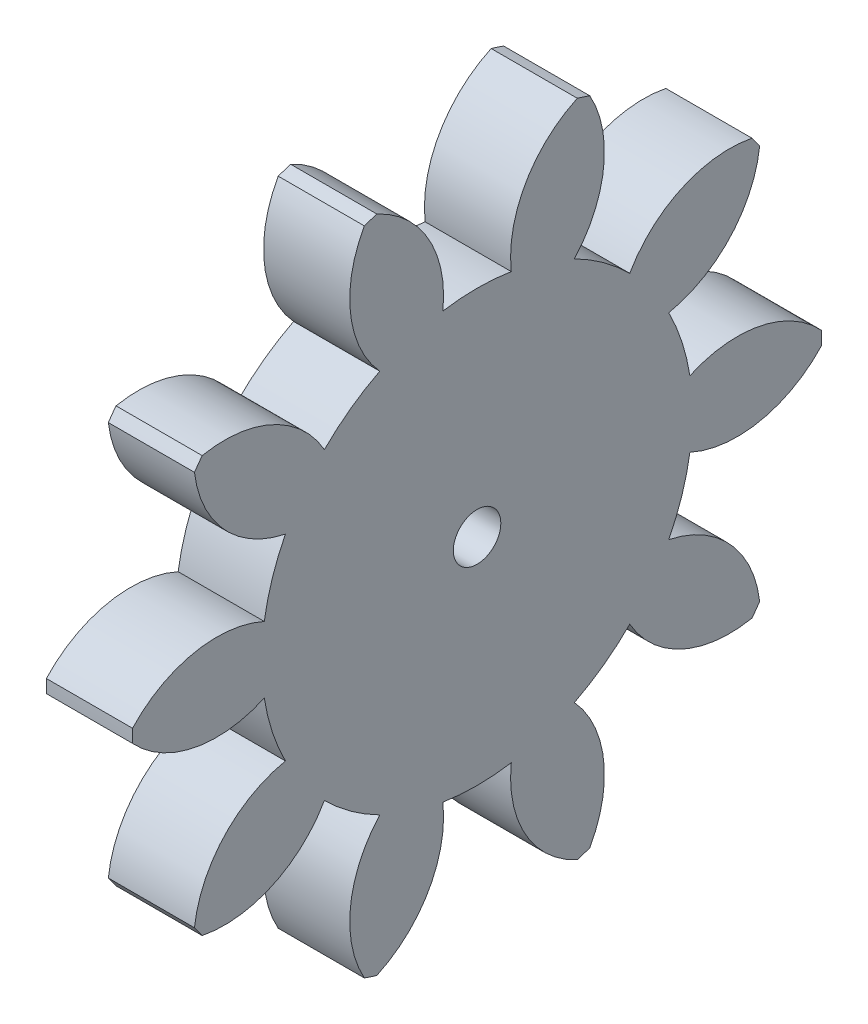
SolidWorks part; units mm, degrees
ref_plane "Plane1" through (0, 0, 0) normal (0, 0, 1) x (1, 0, 0)
ref_plane "Plane2" through (0, 0, 0) normal (0, 1, 0) x (1, 0, 0)
ref_plane "Plane3" through (0, 0, 0) normal (1, 0, 0) x (0, 0, -1)
sketch "HoldingSke" plane through (0, 0, 0) normal (0, 1, 0) x (1, 0, 0)
  line L0 (0, 0) -> (150.0847, -26.464)
  line L1 (-15, 0) -> (100, 0) construction
  line L2 (0, 0) -> (-2.1039, 2.3779)
  line L3 (0, 0) -> (-11.863, 4.5341)
  line L4 (0, 0) -> (8.5048, 1.4996)
  line L5 (0, 0) -> (-47.5972, -17.7524)
  line L6 (0, 0) -> (-5.2639, -3.5516)
  line L7 (-2.1039, 2.3779) -> (8.8308, 51.9871)
  line L8 (-76.2, 54.61) -> (-69.596, 54.61)
  line L9 (-71.009, 38.7566) -> (-53.1078, 45.2721)
  line L10 (-76.2, 71.12) -> (104.1128, 71.12)
  line L11 (0, 0) -> (-6.35, 0)
  line L12 (-76.2, 101.6) -> (-76.0298, 101.6)
  line L13 (24.9733, 27.94) -> (52.9518, 28.4284)
  line L14 (24.9733, 27.94) -> (24.9746, 27.94)
  line L15 (24.9733, 27.94) -> (100.4006, 29.5858)
  circle A0 centre (0, 0) radius 3.175
  circle A1 centre (0, 0) radius 15.8737
  circle A2 centre (0, 0) radius 38.1
  circle A3 centre (0, 0) radius 3.175
  dimension "MHD" = 31.7475
  dimension "Hub_dia" = 76.2
  dimension "Bore" = 6.35
  dimension "MBD" = 6.35
  dimension "Num_teeth" = 10
  dimension "Pitch_radius" = 180.3128
  dimension "Pitch" = 152.4
  dimension "Width" = 6.35
  dimension "Overall_len" = 50.8
  dimension "Show_teeth" = 10
  dimension "Thickness" = 6.35
  dimension "OAL" = 50.8001
  dimension "T_dim" = 6.604
  dimension "Ap" = 20
  dimension "H" = 19.05
  dimension "Backlash" = 0.1702
  dimension "Addendum_fac" = 1
  dimension "Dedendum_fac" = 1.25
  dimension "Clearance_fac" = 0.25
  dimension "Dedendum_add" = 0.0013
sketch "BasProSke" plane through (0, 0, 0) normal (0, 1, 0) x (1, 0, 0)
  line L0 (-10, 0) -> (60, 0) construction
  line L1 (0, 0) -> (0, 25.4)
  line L2 (0, 0) -> (6.35, 0)
  line L3 (6.35, 0) -> (6.35, 25.4)
  line L4 (6.35, 25.4) -> (0, 25.4)
  dimension "Diameter" = 50.8
  dimension "Thickness" = 6.35
revolve "Base-Revolve" add sketch "BasProSke" angle 360 about L0
sketch "TooCutSke" plane through (0, 0, 0) normal (1, 0, 0) x (0, 0, -1)
  line L1 (0, 0) -> (0, 107) construction
  line L2 (0, 0) -> (-3.6083, 20.8568) construction
  line L3 (0, 0) -> (-12.9485, 39.8513) construction
  line L4 (-3.6083, 20.8568) -> (-6.4742, 19.9257) construction
  arc A0 (2.5213, 15.6722) -> (-2.5213, 15.6722) centre (0, 0) ccw
  arc A1 (7.4225, 24.3178) -> (-7.4225, 24.3178) centre (0, 0) ccw
  circle A2 centre (0, 0) radius 21.1667 construction
  circle A3 centre (0, 0) radius 19.8902 construction
  arc A4 (-2.5213, 15.6722) -> (-7.4225, 24.3178) centre (-10.9354, 16.6143) ccw
  arc A5 (7.4225, 24.3178) -> (2.5213, 15.6722) centre (10.9354, 16.6143) ccw
  dimension "Root_dia" = 31.7475
  dimension "Overcut_dia" = 50.8508
  dimension "Pitch_dia" = 42.3333
  dimension "Base_dia" = 39.7803
  dimension "Flank_rad" = 8.4667
  dimension "Half_ang" = 18
  dimension "Half_CT" = 3.0134
extrude "ToothCut" cut sketch "TooCutSke" along normal through all
fillet "Breaks" [suppressed] radius 0.0847
fillet "RootFillets" [suppressed] radius 1.0596
pattern_circular "TeethCuts" count 10 every 36 about axis through (-10, 0, 0) along (1, 0, 0) of "ToothCut", "RootFillets", "Breaks"
sketch "HubNeaOneSke" plane through (0, 0, 0) normal (-1, 0, 0) x (0, 0, 1)
  circle A0 centre (0, 0) radius 15.8737
  dimension "Diameter" = 31.7475
extrude "HubNearOne" [suppressed] add sketch "HubNeaOneSke" along normal blind 44.4501
sketch "HubNeaBotSke" plane through (0, 0, 0) normal (-1, 0, 0) x (0, 0, 1)
  circle A0 centre (0, 0) radius 15.8737
  dimension "Diameter" = 31.7475
extrude "HubNearBoth" [suppressed] add sketch "HubNeaBotSke" along normal blind 22.225
ref_plane "FarPln" through (6.35, 0, 0) normal (1, 0, 0) x (0, 0, -1)
sketch "HubFarSke" plane through (6.35, 0, 0) normal (1, 0, 0) x (0, 0, -1)
  circle A0 centre (0, 0) radius 15.8737
  dimension "Diameter" = 31.7475
extrude "HubFar" [suppressed] add sketch "HubFarSke" along normal blind 22.225
sketch "BorSke" plane through (0, 0, 0) normal (1, 0, 0) x (0, 0, -1)
  circle A0 centre (0, 0) radius 3.175
  dimension "Diameter" = 6.35
extrude "Bore" cut sketch "BorSke" along normal mid plane 101.6001
sketch "KeySke" plane through (0, 0, 0) normal (1, 0, 0) x (0, 0, -1)
  line L0 (-0.127, 0) -> (-0.127, 3.429)
  line L1 (-0.127, 3.429) -> (0.127, 3.429)
  line L2 (0.127, 3.429) -> (0.127, 0)
  line L3 (0, 0) -> (0, 34) construction
  line L4 (-0.127, 0) -> (0.127, 0)
  dimension "Offset" = 3.429
  dimension "Width" = 0.254
extrude "Keyway" [suppressed] cut sketch "KeySke" along normal mid plane 101.6001
pattern_circular "Keyway2" [suppressed] count 2 every 90 about axis through (-10, 0, 0) along (1, 0, 0)
sketch "Sketch1" plane through (6.35, 0, 0) normal (1, 0, 0) x (0, 0, -1)
  circle A0 centre (0, 0) radius 3.175
  circle A1 centre (0, 0) radius 3.175 construction
  circle A2 centre (0, 0) radius 1.75
  dimension "D1" = 3.5
extrude "Boss-Extrude1" add sketch "Sketch1" against normal up to surface (6.35 mm away)
equation "' \"Pitch@HoldingSke\" = 4"
equation "' \"Num_teeth@HoldingSke\" = 12"
equation "' \"Ap@HoldingSke\" =  20"
equation "' \"Width@HoldingSke\" = 0.5"
equation "' \"Hub_dia@HoldingSke\"= 1"
equation "' \"Overall_len@HoldingSke\" = 1.0"
equation "' \"Bore@HoldingSke\" = 0.75"
equation "' \"T_dim@HoldingSke\" = 0.85"
equation "' \"Width@KeySke\" = 0.25"
equation "' \"Show_teeth@HoldingSke\" = 13"
equation "' \"Backlash@HoldingSke\" = 0.009"
equation "' \"Addendum_fac@HoldingSke\" = 1.0"
equation "' \"Dedendum_fac@HoldingSke\" = 1.25"
equation "' \"Dedendum_add@HoldingSke\" = 0.00005"
equation "' \"Clearance_fac@HoldingSke\" = 0.25"
equation "' \"Pitch@HoldingSke\" = 0.5"
equation "' \"Num_teeth@HoldingSke\" = 23"
equation "' \"Show_teeth@HoldingSke\" = 23"
equation "' \"Backlash@HoldingSke\" = 0.0375"
equation "\"Overcut_dia@TooCutSke\" = (\"Num_teeth@HoldingSke\" + 2 * \"Addendum_fac@HoldingSke\") / \"Pitch@HoldingSke\" + 0.002"
equation "\"Pitch_dia@TooCutSke\" = \"Num_teeth@HoldingSke\" / \"Pitch@HoldingSke\""
equation "\"Base_dia@TooCutSke\" = \"Num_teeth@HoldingSke\" / \"Pitch@HoldingSke\" * cos((\"Ap@HoldingSke\"  * 3.14159265 / 180))"
equation "\"Root_dia@TooCutSke\" = (\"Num_teeth@HoldingSke\" + 2) / \"Pitch@HoldingSke\" - 2 * (\"Addendum_fac@HoldingSke\" + \"Dedendum_fac@HoldingSke\") / \"Pitch@HoldingSke\" - \"Dedendum_add@HoldingSke\" * 2"
equation "\"Half_ang@TooCutSke\" = 180 / \"Num_teeth@HoldingSke\""
equation "\"Half_CT@TooCutSke\" = \"Num_teeth@HoldingSke\" / \"Pitch@HoldingSke\" * sin((3.14159265 / 2 / \"Num_teeth@HoldingSke\")) / 2 - 7 * \"Backlash@HoldingSke\" / 4"
equation "\"Flank_rad@TooCutSke\" = \"Num_teeth@HoldingSke\" / \"Pitch@HoldingSke\" / 5"
equation "\"Radius@RootFillets\" = \"Clearance_fac@HoldingSke\" / \"Pitch@HoldingSke\" + \"Dedendum_add@HoldingSke\""
equation "\"Break_rad@Breaks\" = 0.02 / \"Pitch@HoldingSke\""
equation "\"Thickness@HoldingSke\" = \"Width@HoldingSke\""
equation "\"OAL@HoldingSke\" = \"Thickness@HoldingSke\""
equation "\"MHD@HoldingSke\" = (\"Num_teeth@HoldingSke\" + 2) / \"Pitch@HoldingSke\" - 2 * (\"Addendum_fac@HoldingSke\" + \"Dedendum_fac@HoldingSke\")  / \"Pitch@HoldingSke\" - \"Dedendum_add@HoldingSke\" * 2"
equation "\"MBD@HoldingSke\" = (\"Num_teeth@HoldingSke\" + 2) / \"Pitch@HoldingSke\" - 2 * (\"Addendum_fac@HoldingSke\" + \"Dedendum_fac@HoldingSke\")  / \"Pitch@HoldingSke\" - \"Dedendum_add@HoldingSke\" * 2 - 0.002"
equation "\"MHD@HoldingSke\" = ((sgn( \"MHD@HoldingSke\" - \"Hub_dia@HoldingSke\" )-1)*( \"MHD@HoldingSke\" - \"Hub_dia@HoldingSke\" ))/-2+ \"Hub_dia@HoldingSke\""
equation "\"MBD@HoldingSke\" = ((sgn( \"MBD@HoldingSke\" - \"Bore@HoldingSke\" )-1)*( \"MBD@HoldingSke\" - \"Bore@HoldingSke\" ))/-2+ \"Bore@HoldingSke\""
equation "\"OAL@HoldingSke\" = ((sgn( \"OAL@HoldingSke\" - \"Overall_len@HoldingSke\" )+1)*( \"OAL@HoldingSke\" - \"Overall_len@HoldingSke\" ))/2 + \"Overall_len@HoldingSke\" + 0.000002"
equation "\"Num_teeth@TeethCuts\" = int( \"Show_teeth@HoldingSke\" ) + 1"
equation "\"Num_teeth@TeethCuts\" = ((sgn( \"Num_teeth@TeethCuts\" - \"Num_teeth@HoldingSke\" )-1)*( \"Num_teeth@TeethCuts\" - \"Num_teeth@HoldingSke\" ))/-2+ \"Num_teeth@HoldingSke\""
equation "\"Num_teeth@TeethCuts\" = ((sgn( \"Num_teeth@TeethCuts\" - 2.0)+1)*( \"Num_teeth@TeethCuts\" - 2.0))/2 +2.0"
equation "\"Angle@TeethCuts\" = 360.0 / \"Num_teeth@HoldingSke\""
equation "\"Diameter@BasProSke\" = (\"Num_teeth@HoldingSke\" + 2 * \"Addendum_fac@HoldingSke\") / \"Pitch@HoldingSke\""
equation "\"Thickness@BasProSke\"  = \"Thickness@HoldingSke\""
equation "' \"Fillet_rad@BasProSke\" =  \"Thickness@HoldingSke\" * 0.05"
equation "\"MHD@HoldingSke\" = ((sgn( \"MHD@HoldingSke\" - \"Root_dia@TooCutSke\" )-1)*( \"MHD@HoldingSke\" - \"Root_dia@TooCutSke\" ))/-2+ \"Root_dia@TooCutSke\""
equation "\"Diameter@HubNeaOneSke\" = \"MHD@HoldingSke\""
equation "\"Length@HubNearOne\" = \"OAL@HoldingSke\" - \"Thickness@BasProSke\""
equation "\"Diameter@HubNeaBotSke\" = \"MHD@HoldingSke\""
equation "\"Length@HubNearBoth\" = ( \"OAL@HoldingSke\" - \"Thickness@BasProSke\" ) / 2.0"
equation "\"Thickness@FarPln\" = \"Thickness@BasProSke\""
equation "\"Diameter@HubFarSke\" = \"MHD@HoldingSke\""
equation "\"Length@HubFar\" = ( \"OAL@HoldingSke\" - \"Thickness@BasProSke\" ) / 2.0"
equation "\"Diameter@BorSke\" = \"MBD@HoldingSke\""
equation "\"D1@Bore\" = \"OAL@HoldingSke\" * 2.0"
equation "\"D1@Keyway\" = \"OAL@HoldingSke\" * 2.0"
equation "\"Offset@KeySke\" = \"T_dim@HoldingSke\" - \"MBD@HoldingSke\" / 2.0"
